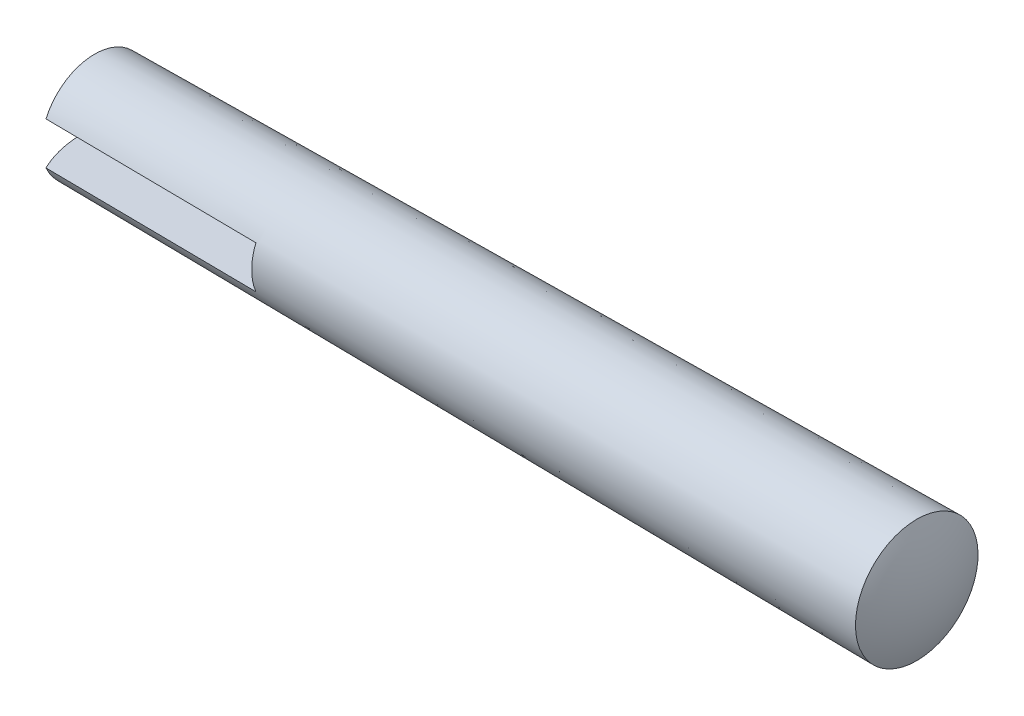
SolidWorks part; units mm, degrees
ref_plane "Plane1" through (0, 0, 0) normal (0, 0, 1) x (1, 0, 0)
ref_plane "Plane2" through (0, 0, 0) normal (0, 1, 0) x (1, 0, 0)
ref_plane "Plane3" through (0, 0, 0) normal (1, 0, 0) x (0, 0, -1)
sketch "Clipboard" plane through (0, 0, 0) normal (0, 0, 1) x (1, 0, 0)
  line L0 (0, 0) -> (10, 0)
  dimension "SplitDepth" = 10
ref_plane "SplitPlane" through (10.63, 0, 0) normal (1, 0, 0) x (0, 0, -1)
sketch "BodySke" plane through (0, 0, 0) normal (0, 0, 1) x (1, 0, 0)
  line L0 (0, 0) -> (210, 0) construction
  line L2 (0.63, 2.5) -> (39.37, 2.8874)
  line L4 (0, 0) -> (40, 0)
  line L5 (0.63, -2.5) -> (39.37, -2.8874) construction
  arc A0 (0.63, 2.5) -> (0, 0) centre (5.2753, 0) ccw
  arc A1 (39.37, 2.8874) -> (40, 0) centre (33.0683, 0) cw
  dimension "D1" = 0.63
  dimension "Diameter" = 5
  dimension "D2" = 0.573
  dimension "Length" = 40
  dimension "Crown_ht" = 0.63
revolve "Body" add sketch "BodySke" angle 360 about L0
sketch "SplSke" plane through (10.63, 0, 0) normal (1, 0, 0) x (0, 0, -1)
  line L0 (-20, 0) -> (20, 0) construction
  line L1 (0, 20) -> (0, -20) construction
  line L3 (-2.8874, -1) -> (2.8874, -1)
  line L4 (-2.8874, -1) -> (-2.8874, 1)
  line L5 (-2.8874, 1) -> (2.8874, 1)
  line L6 (2.8874, -1) -> (2.8874, 1)
  circle A0 centre (0, 0) radius 2.8874 construction
  dimension "Width" = 2
extrude "Split" cut sketch "SplSke" against normal through all
equation "\"D1@BodySke\" = \"Crown_ht@BodySke\""
equation "\"Offset@SplitPlane\" = \"SplitDepth@Clipboard\" + \"Crown_ht@BodySke\""
